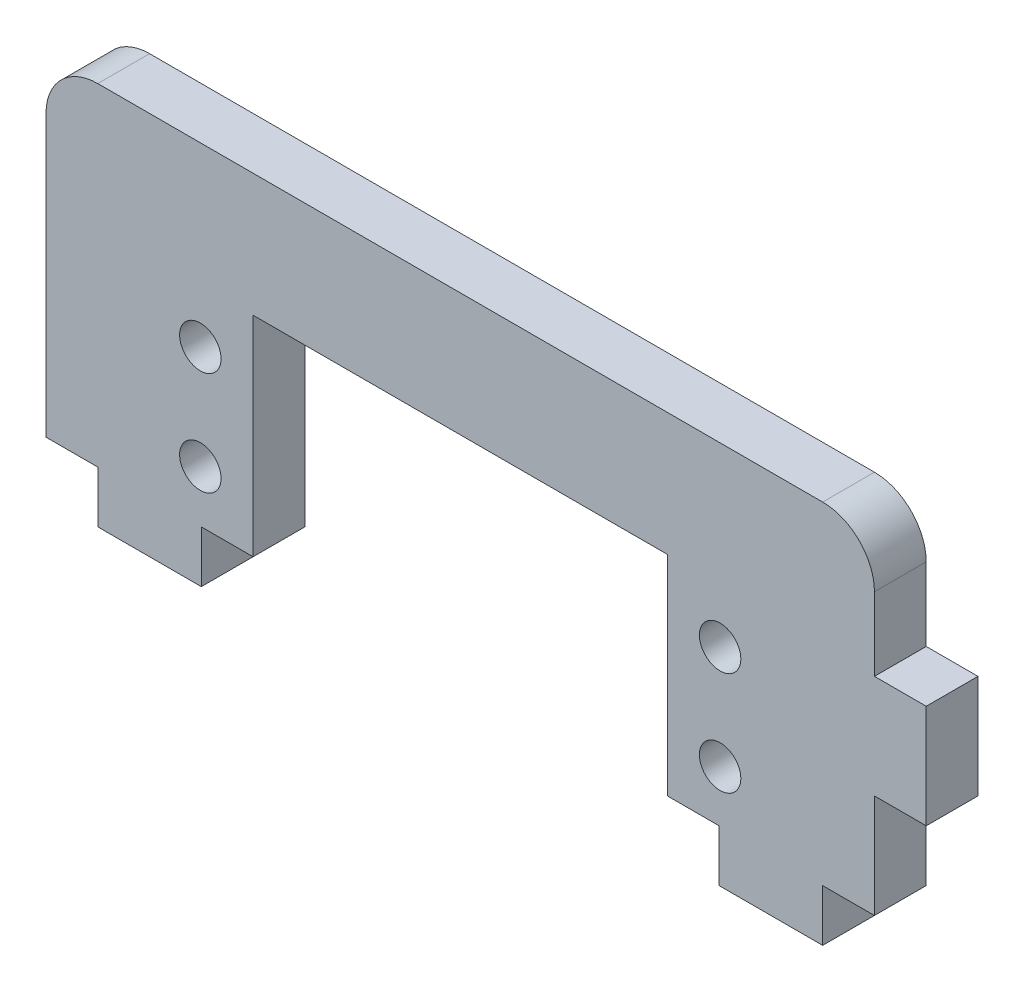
SolidWorks part; units mm, degrees
ref_plane "Plan de face" through (0, 0, 0) normal (0, 0, 1) x (1, 0, 0)
ref_plane "Plan de dessus" through (0, 0, 0) normal (0, 1, 0) x (1, 0, 0)
ref_plane "Plan de droite" through (0, 0, 0) normal (1, 0, 0) x (0, 0, -1)
sketch "Esquisse1" plane through (0, 0, 0) normal (0, 0, 1) x (1, 0, 0)
  line L0 (60, 0) -> (80, 0)
  line L1 (0, 0) -> (20, 0)
  line L2 (0, 0) -> (0, 27.0753)
  line L3 (5, 32.0753) -> (75, 32.0753)
  line L4 (80, 0) -> (80, 27.0753)
  line L6 (20, 0) -> (20, 20.2)
  line L7 (20, 20.2) -> (60, 20.2)
  line L8 (60, 0) -> (60, 20.2)
  arc A0 (0, 27.0753) -> (5, 32.0753) centre (5, 27.0753) cw
  arc A1 (75, 32.0753) -> (80, 27.0753) centre (75, 27.0753) cw
  point P11 (0, 32.0753)
  point P14 (80, 32.0753)
  dimension "D5" = 5
  dimension "D6" = 5
  dimension "D1" = 40
  dimension "D2" = 20.2
  dimension "D3" = 80
  dimension "D4" = 20
extrude "Boss.-Extru.1" add sketch "Esquisse1" along normal blind 5
sketch "Esquisse2" plane through (0, 0, 5) normal (0, 0, 1) x (1, 0, 0)
  line L0 (40, 32.0753) -> (40, 0) construction
  line L1 (75, 32.0753) -> (5, 32.0753) construction
  line L2 (10.9135, 10) -> (71.1488, 10) construction
  line L3 (0, 0) -> (20, 0) construction
  line L4 (65.0971, 15) -> (65.0971, 5) construction
  circle A0 centre (65.0971, 15) radius 2
  circle A1 centre (65.0971, 5) radius 2
  circle A2 centre (14.9029, 5) radius 2
  circle A3 centre (14.9029, 15) radius 2
  dimension "D1" = 10
  dimension "D2" = 10
  dimension "D3" = 5
extrude "Enlèv. mat.-Extru.1" cut sketch "Esquisse2" against normal blind 5
sketch "Esquisse3" plane through (0, 0, 0) normal (0, -1, 0) x (1, 0, 0)
  line L0 (0, 5) -> (20, 5) construction
  line L1 (5, 5) -> (15, 5)
  line L2 (5, 5) -> (5, 0)
  line L3 (5, 0) -> (15, 0)
  line L4 (15, 5) -> (15, 0)
  line L5 (0, 0) -> (20, 0) construction
  line L6 (60, 5) -> (80, 5) construction
  line L7 (65, 5) -> (75, 5)
  line L8 (65, 5) -> (65, 0)
  line L9 (65, 0) -> (75, 0)
  line L10 (75, 5) -> (75, 0)
  line L11 (60, 0) -> (80, 0) construction
  line L12 (0, 5) -> (0, 0) construction
  line L13 (60, 5) -> (60, 0) construction
  point P16 (0, 2.5)
  dimension "D1" = 10
  dimension "D2" = 5
  dimension "D3" = 5
  dimension "D4" = 10
extrude "Boss.-Extru.2" add sketch "Esquisse3" along normal blind 5
sketch "Esquisse4" plane through (80, 0, 0) normal (1, 0, 0) x (0, 0, -1)
  line L2 (-5, 0) -> (-5, 27.0753) construction
  line L3 (-5, 20) -> (0, 20)
  line L4 (-5, 20) -> (-5, 10)
  line L5 (-5, 10) -> (0, 10)
  line L7 (0, 20) -> (0, 10)
  line L8 (0, 0) -> (0, 27.0753) construction
  line L9 (-5, 0) -> (0, 0) construction
  dimension "D1" = 10
  dimension "D2" = 10
extrude "Boss.-Extru.3" add sketch "Esquisse4" along normal blind 5
